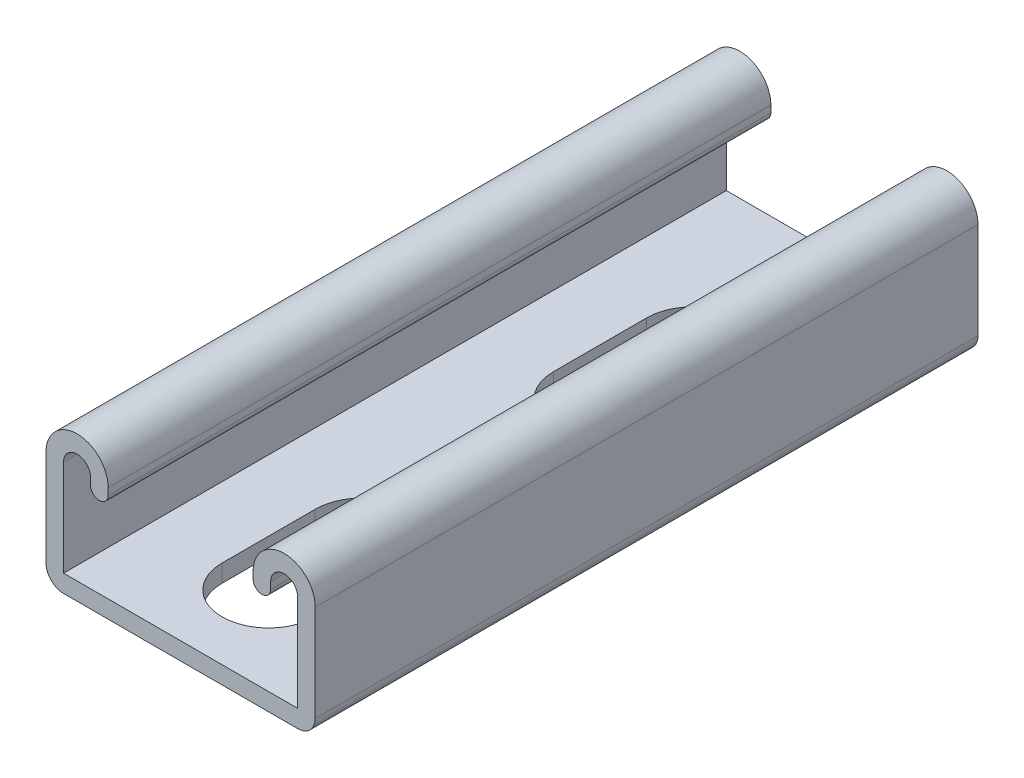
SolidWorks part; units mm, degrees
ref_plane "Plane1" through (0, 0, 0) normal (0, 0, 1) x (1, 0, 0)
ref_plane "Plane2" through (0, 0, 0) normal (0, 1, 0) x (1, 0, 0)
ref_plane "Plane3" through (0, 0, 0) normal (1, 0, 0) x (0, 0, -1)
sketch "Sketch1" plane through (0, 0, 0) normal (0, 0, 1) x (1, 0, 0)
  line L0 (-20.6375, 8.3693) -> (-20.6375, -6.4008)
  line L1 (-17.9451, -9.0932) -> (17.9451, -9.0932)
  line L2 (20.6375, -6.4008) -> (20.6375, 8.3693)
  line L3 (11.1125, 8.3693) -> (11.1125, 7.3343)
  line L4 (-11.1125, 8.3693) -> (-11.1125, 7.3343)
  line L5 (-13.8049, 8.3693) -> (-13.8049, 7.3343)
  line L6 (-17.9451, 8.3693) -> (-17.9451, -6.4008)
  line L7 (-17.9451, -6.4008) -> (17.9451, -6.4008)
  line L8 (17.9451, -6.4008) -> (17.9451, 8.3693)
  line L9 (13.8049, 8.3693) -> (13.8049, 7.3343)
  line L10 (-25.4, 13.1318) -> (25.4, 13.1318) construction
  line L11 (-12.8524, 5.9881) -> (12.8524, 5.9881) construction
  arc A0 (20.6375, 8.3693) -> (11.1125, 8.3693) centre (15.875, 8.3693) ccw
  arc A1 (-20.6375, 8.3693) -> (-11.1125, 8.3693) centre (-15.875, 8.3693) cw
  arc A2 (-17.9451, -9.0932) -> (-20.6375, -6.4008) centre (-17.9451, -6.4008) cw
  arc A3 (17.9451, -9.0932) -> (20.6375, -6.4008) centre (17.9451, -6.4008) ccw
  arc A4 (-17.9451, 8.3693) -> (-13.8049, 8.3693) centre (-15.875, 8.3693) cw
  arc A5 (17.9451, 8.3693) -> (13.8049, 8.3693) centre (15.875, 8.3693) ccw
  arc A6 (11.1125, 7.3343) -> (13.8049, 7.3343) centre (12.4587, 7.3343) ccw
  arc A7 (-11.1125, 7.3343) -> (-13.8049, 7.3343) centre (-12.4587, 7.3343) cw
  dimension "D1" = 2.6924
  dimension "D3" = 20.6375
  dimension "Width" = 41.275
  dimension "D5" = 9.0932
  dimension "D6" = 9.525
  dimension "D7" = 22.225
  dimension "D8" = 13.1318
  dimension "D9" = 7.1437
  dimension "gauge" = 2.6924
extrude "Base-Extrude" add sketch "Sketch1" along normal blind 101.6
extrude "Slot" cut sketch "Sketch2" against normal through all
sketch "Sketch2" plane through (0, -9.0932, -16.7242) normal (0, -1, 0) x (1, 0, 0)
  line L0 (7.1437, 54.0305) -> (7.1438, 39.743)
  line L1 (-7.1438, 39.743) -> (-7.1438, 54.0305)
  arc A0 (-7.1438, 39.743) -> (7.1438, 39.743) centre (0, 39.743) ccw
  arc A1 (7.1437, 54.0305) -> (-7.1438, 54.0305) centre (0, 54.0305) ccw
  dimension "D3" = 14.2875
  dimension "D1" = 23.0188
  dimension "D2" = 14.2875
pattern_linear "LPattern1" count 2 spacing 50.8 along (0, 0, 1) of "Slot"
equation "\"D3@Sketch1\" = \"Width@Sketch1\" / 2"
equation "\"D7@Sketch1\" = \"Width@Sketch1\" - 2 * \"D6@Sketch1\""
equation "\"D1@Sketch1\" = \"gauge@Sketch1\""
equation "\"D1@LPattern1\" = \"D1@Base-Extrude\" / \"D3@LPattern1\""
